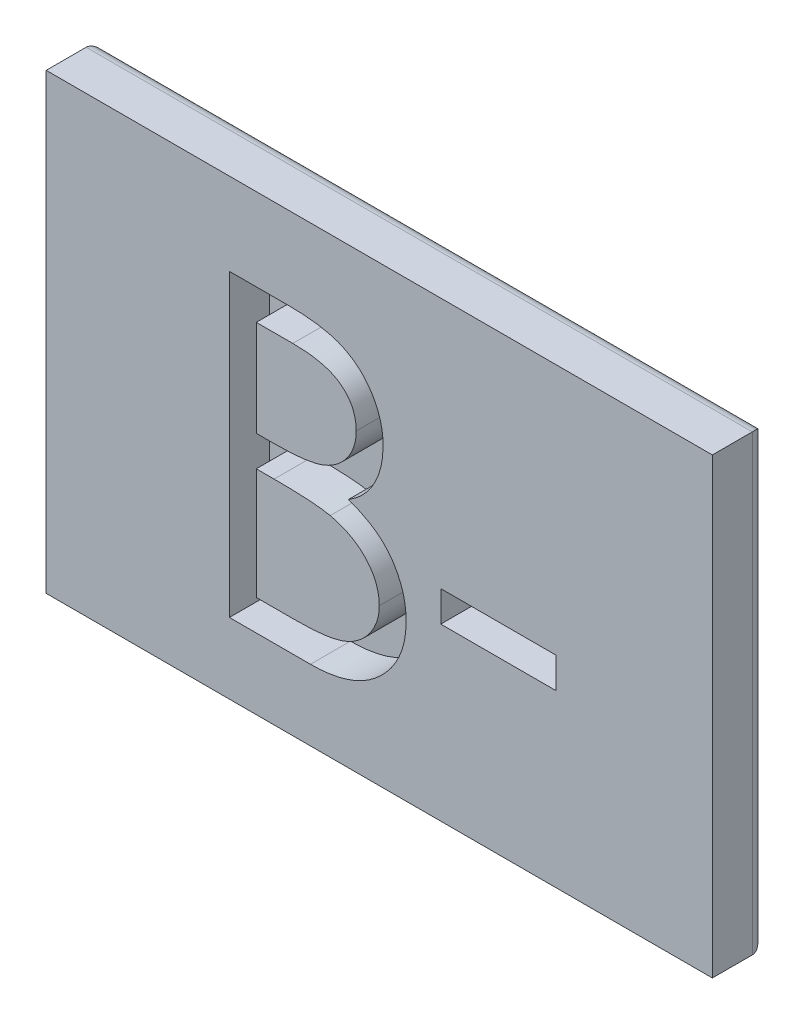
SolidWorks part; units mm, degrees
ref_plane "Front Plane" through (0, 0, 0) normal (0, 0, 1) x (1, 0, 0)
ref_plane "Top Plane" through (0, 0, 0) normal (0, 1, 0) x (1, 0, 0)
ref_plane "Right Plane" through (0, 0, 0) normal (1, 0, 0) x (0, 0, -1)
sketch "Sketch1" plane through (0, 0, 0) normal (0, 0, 1) x (1, 0, 0)
  line L1 (-15.875, -10.795) -> (15.875, -10.795)
  line L2 (-15.875, -10.795) -> (-15.875, 10.795)
  line L3 (-15.875, 10.795) -> (15.875, 10.795)
  line L4 (15.875, -10.795) -> (15.875, 10.795)
  line L5 (-15.875, -10.795) -> (15.875, 10.795) construction
  line L6 (-15.875, 10.795) -> (15.875, -10.795) construction
  point P0 (0, 0)
  dimension "D1" = 31.75
  dimension "D2" = 21.59
extrude "Boss-Extrude1" add sketch "Sketch1" along normal blind 2.54
fillet "Fillet1" radius 0.635 4 edges at (-15.875, 0, 0) (0, -10.795, 0) (0, 10.795, 0) (15.875, 0, 0)
sketch "Sketch2" plane through (0, 0, 2.54) normal (0, 0, 1) x (1, 0, 0)
  line L0 (-15.875, 10.795) -> (-14.977, 9.897) construction
  line L2 (-14.977, 9.897) -> (-14.977, 4.9485) construction
  line L3 (-14.977, 4.9485) -> (-14.977, 0) construction
  line L4 (-14.977, 0) -> (-14.977, -4.9485) construction
  line L5 (-14.977, -4.9485) -> (-14.977, -9.897) construction
  line L6 (-14.977, -9.897) -> (-15.875, -10.795) construction
  line L7 (15.875, 10.795) -> (-15.875, 10.795) construction
  line L8 (-15.875, -10.795) -> (15.875, -10.795) construction
  line L9 (-14.977, 4.9485) -> (14.977, 4.9485) construction
  line L10 (14.977, 4.9485) -> (14.977, 0) construction
  line L11 (14.977, 0) -> (-14.977, 0) construction
  line L12 (14.977, 0) -> (14.977, -4.9485) construction
  line L13 (14.977, -4.9485) -> (-14.977, -4.9485) construction
  line L14 (-14.977, -9.897) -> (14.977, -9.897) construction
  line L15 (14.977, -9.897) -> (14.977, -4.9485) construction
  line L16 (-14.977, 9.897) -> (14.977, 9.897) construction
  line L17 (14.977, 9.897) -> (14.977, 4.9485) construction
  line L18 (14.977, 9.897) -> (15.875, 10.795) construction
  line L19 (14.977, -9.897) -> (15.875, -10.795) construction
  line L20 (-14.977, -7.4227) -> (14.977, -7.4227) construction
  text T0 "B-" font "Century Gothic" height 14.2875
  dimension "D1" = 45
  dimension "D2" = 45
  dimension "D3" = 1.27
extrude "Cut-Extrude1" cut sketch "Sketch2" against normal blind 1.905
